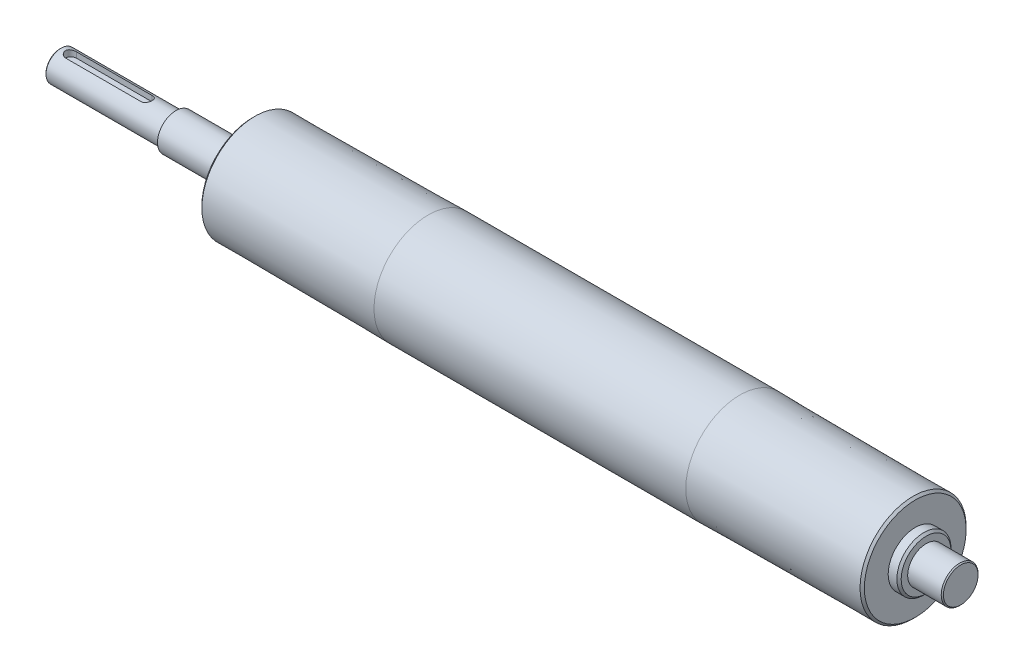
SolidWorks part; units mm, degrees
ref_plane "Front" through (0, 0, 0) normal (0, 0, 1) x (1, 0, 0)
ref_plane "Top" through (0, 0, 0) normal (0, 1, 0) x (1, 0, 0)
ref_plane "Right" through (0, 0, 0) normal (1, 0, 0) x (0, 0, -1)
sketch "Sketch2" plane through (0, 0, 0) normal (0, 1, 0) x (1, 0, 0)
  line L0 (-72, 25) -> (72, 25)
  line L1 (0, 25) -> (0, 0) construction
  line L2 (72, 25) -> (152, 24.5)
  line L3 (-72, 25) -> (-152, 24.5)
  line L4 (-226, 0) -> (174, 0)
  line L5 (152, 24.5) -> (153, 23.5)
  line L6 (153, 23.5) -> (153, 12.5)
  line L7 (153, 12.5) -> (157, 12.5)
  line L8 (157, 12.5) -> (158, 11.5)
  line L9 (158, 11.5) -> (158, 8.5)
  line L10 (158, 8.5) -> (173.5, 8.5)
  line L11 (173.5, 8.5) -> (174, 8)
  line L12 (174, 8) -> (174, 0)
  line L13 (-152, 24.5) -> (-153, 23.5)
  line L14 (-153, 23.5) -> (-153, 12.5)
  line L15 (-153, 12.5) -> (-157, 12.5)
  line L16 (-157, 12.5) -> (-158, 11.5)
  line L17 (-158, 11.5) -> (-158, 8.5)
  line L18 (-158, 8.5) -> (-188.5, 8.5)
  line L19 (-188.5, 8.5) -> (-188.5, 7)
  line L20 (-188.5, 7) -> (-241.5, 7)
  line L21 (-242, 6.5) -> (-242, 3)
  line L22 (-242, 3) -> (-226, 3)
  line L23 (-226, 3) -> (-226, 0)
  line L24 (-241.5, 7) -> (-242, 6.5)
  dimension "D1" = 25
  dimension "D2" = 80
  dimension "D3" = 80
  dimension "D4" = 24.5
  dimension "D5" = 24.5
  dimension "D6" = 45
  dimension "D7" = 1
  dimension "D8" = 12.5
  dimension "D9" = 4
  dimension "D10" = 1
  dimension "D11" = 8.5
  dimension "D12" = 0.5
  dimension "D13" = 16
  dimension "D14" = 45
  dimension "D15" = 1
  dimension "D16" = 12.5
  dimension "D17" = 1
  dimension "D18" = 8.5
  dimension "D19" = 4
  dimension "D20" = 30.5
  dimension "D21" = 84
  dimension "D22" = 16
  dimension "D23" = 0.5
  dimension "D24" = 3
  dimension "D25" = 7
  dimension "D26" = 306
  dimension "D27" = 21
revolve "Revolve2" add sketch "Sketch2" angle 360 about L4
ref_plane "Plane1" through (0, 7, 0) normal (0, 1, 0) x (-1, 0, 0)
sketch "Sketch3" plane through (0, 7, 0) normal (0, 1, 0) x (-1, 0, 0)
  line L0 (202, 2.5) -> (237, 2.5)
  line L1 (202, -2.5) -> (237, -2.5)
  line L3 (241.5, 7) -> (188.5, 7) construction
  line L4 (241.5, 7) -> (188.5, 7)
  line L5 (188.5, -7) -> (241.5, -7) construction
  line L6 (188.5, -7) -> (241.5, -7)
  line L7 (242, -6.5) -> (242, 6.5) construction
  arc A0 (202, 2.5) -> (202, -2.5) centre (202, 0) ccw
  arc A1 (237, -2.5) -> (237, 2.5) centre (237, 0) ccw
  dimension "D1" = 2.5
  dimension "D2" = 2.5
  dimension "D3" = 7
  dimension "D4" = 5
  dimension "D5" = 35
extrude "Extrude1" cut sketch "Sketch3" against normal blind 3 contours L0 A1 L1 A0
